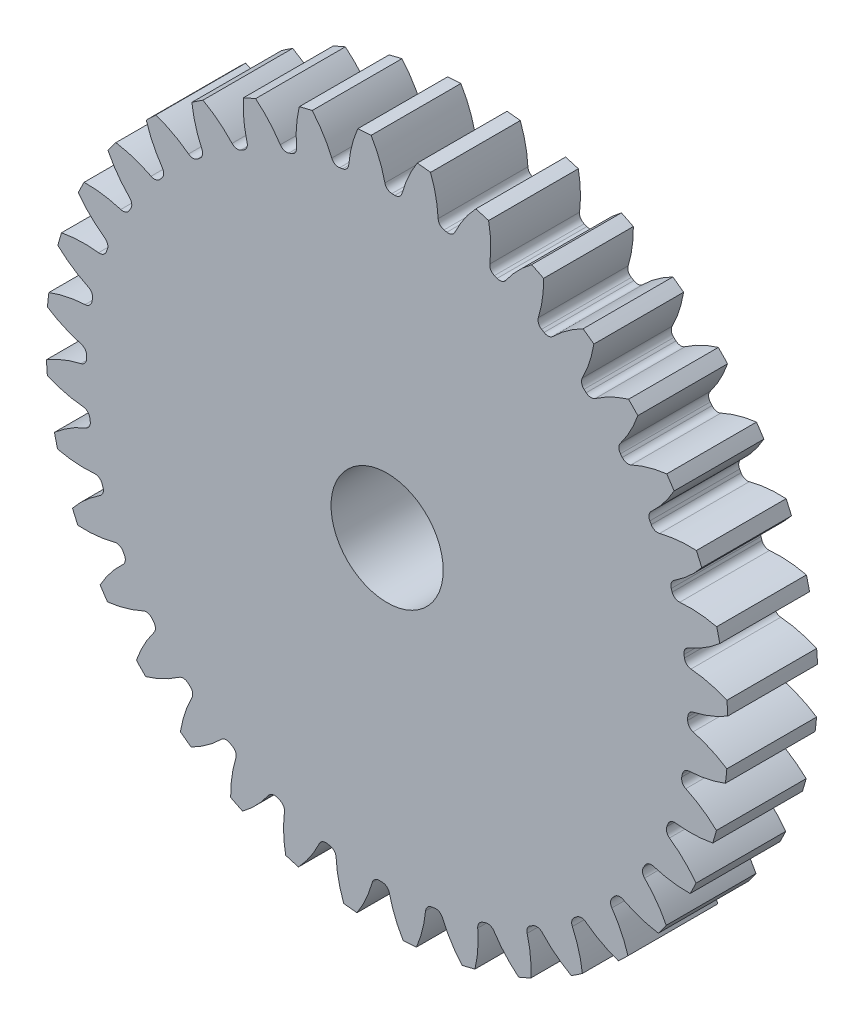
SolidWorks part; units mm, degrees
ref_plane "Front" through (0, 0, 0) normal (0, 0, 1) x (1, 0, 0)
ref_plane "Top" through (0, 0, 0) normal (0, 1, 0) x (1, 0, 0)
ref_plane "Right" through (0, 0, 0) normal (1, 0, 0) x (0, 0, -1)
sketch "Sketch3" plane through (0, 0, 0) normal (0, 0, 1) x (1, 0, 0)
  circle A0 centre (0, 0) radius 386.08
  dimension "od" = 772.16
extrude "gearBody" add sketch "Sketch3" along normal blind 101.6
sketch "Sketch2" plane through (0, 0, 0) normal (0, 0, 1) x (1, 0, 0)
  line L0 (0, 0) -> (317.5392, 131.529) construction
  line L1 (384.982, -34.4097) -> (0, 0) construction
  line L2 (0, 0) -> (36.3143, 0) construction
  line L3 (365.666, 8.293) -> (365.0046, -23.4945) construction
  line L5 (365.3353, -7.6008) -> (0, 0) construction
  line L7 (0, 0) -> (343.702, 0) construction
  arc A0 (343.697, 1.8406) -> (343.3231, -16.134) centre (0, 0) ccw construction
  arc A1 (385.655, 18.1114) -> (384.568, -34.1358) centre (0, 0) ccw construction
  arc A2 (365.666, 8.293) -> (365.0046, -23.4945) centre (0, 0) ccw construction
  arc A3 (340.2482, -8.7213) -> (340.3166, -5.4378) centre (0, 0) ccw
  arc A4 (384.982, -34.4097) -> (346.3553, -16.9163) centre (311.7939, -144.6223) ccw
  arc A5 (384.982, -34.4097) -> (386.08, 18.3677) centre (0, 0) ccw
  arc A6 (386.08, 18.3677) -> (346.7592, 2.4961) centre (317.5392, 131.529) cw
  arc A7 (340.3166, -5.4378) -> (346.7592, 2.4961) centre (348.5857, -5.57) cw
  arc A8 (346.3553, -16.9163) -> (340.2482, -8.7213) centre (348.5158, -8.9332) cw
  point P6 (386.08, 18.3677)
  point P22 (384.982, -34.4097)
  dimension "baseDia" = 687.4039
  dimension "od" = 772.16
  dimension "pd" = 731.52
  dimension "rd" = 680.72
  dimension "rFillet" = 8.2702
  dimension "pointX" = 386.08
  dimension "pointY" = 18.3677
  dimension "CTT" = 31.7875
  dimension "flankCenterAngle" = 22.5
extrude "toothCut" cut sketch "Sketch2" along normal through all
pattern_circular "CirPattern1" count 36 over 360 about axis through (0, 0, 0) along (0, 0, 1) of "toothCut"
sketch "hub1Dia" plane through (0, 0, 0) normal (0, 0, -1) x (-1, 0, 0)
  circle A0 centre (0, 0) radius 12.7
  dimension "hub1Dia" = 25.4
sketch "hub2Dia" plane through (0, 0, 101.6) normal (0, 0, 1) x (1, 0, 0)
  circle A0 centre (0, 0) radius 12.7
  dimension "hub2dia" = 25.4
sketch "boreDia" plane through (0, 0, 0) normal (0, 0, 1) x (1, 0, 0)
  circle A0 centre (0, 0) radius 63.5
  dimension "boreDia" = 127
extrude "bore" cut sketch "boreDia" against normal mid plane 25400
